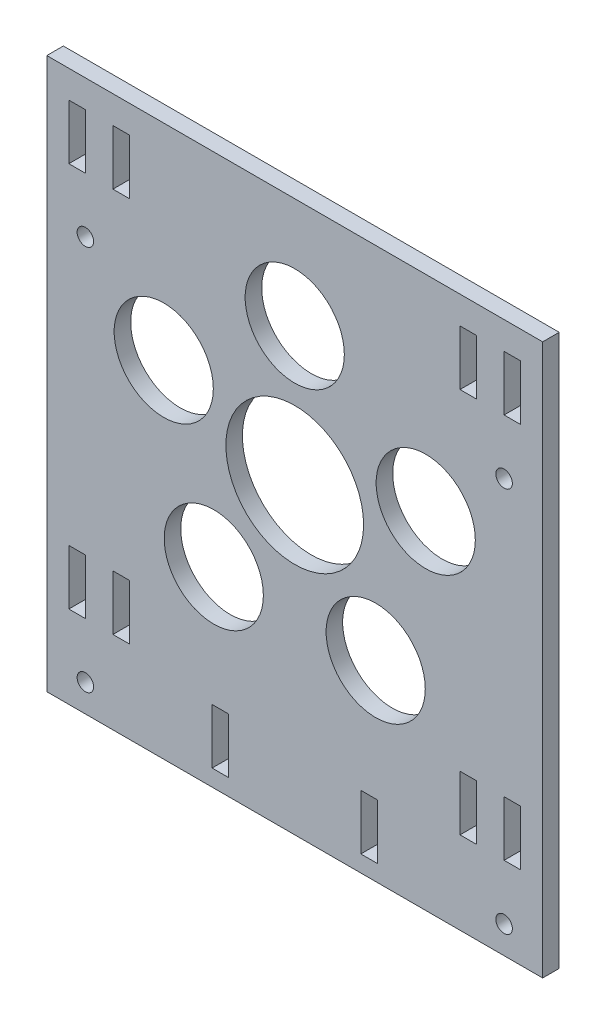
SolidWorks part; units mm, degrees
ref_plane "前视基准面" through (0, 0, 0) normal (0, 0, 1) x (1, 0, 0)
ref_plane "上视基准面" through (0, 0, 0) normal (0, 1, 0) x (1, 0, 0)
ref_plane "右视基准面" through (0, 0, 0) normal (1, 0, 0) x (0, 0, -1)
sketch "草图1" plane through (0, 0, 0) normal (0, 0, 1) x (1, 0, 0)
  line L0 (0, 0) -> (-23.7764, 7.7254) construction
  circle A0 centre (0, 0) radius 12.5
  circle A1 centre (0, 25) radius 12.5
  circle A2 centre (23.7764, 7.7254) radius 12.5
  circle A3 centre (14.6946, -20.2254) radius 12.5
  circle A4 centre (-14.6946, -20.2254) radius 12.5
  circle A5 centre (-23.7764, 7.7254) radius 12.5
  circle A6 centre (-23.7764, 7.7254) radius 10.5
  circle A7 centre (0, 25) radius 10.5
  circle A8 centre (23.7764, 7.7254) radius 10.5
  circle A9 centre (-14.6946, -20.2254) radius 10.5
  circle A10 centre (14.6946, -20.2254) radius 10.5
  circle A11 centre (-23.7764, 7.7254) radius 9
  circle A12 centre (0, 25) radius 9
  circle A13 centre (23.7764, 7.7254) radius 9
  circle A14 centre (14.6946, -20.2254) radius 9
  circle A15 centre (-14.6946, -20.2254) radius 9
  circle A17 centre (0, 0) radius 35.5
  point P16 (0, 0)
  dimension "D1" = 25
  dimension "D2" = 25
  dimension "D4" = 21
  dimension "D5" = 21
  dimension "D6" = 21
  dimension "D7" = 21
  dimension "D8" = 18
  dimension "D11" = 21
  dimension "D3" = 5
  dimension "D10" = 25
  dimension "D9" = 5
sketch "草图2" plane through (0, 0, 0) normal (0, 0, 1) x (1, 0, 0)
  line L0 (-10.5, 25) -> (-10.5, 27.9643)
  line L1 (10.5, 25) -> (10.5, 27.9643)
  line L2 (20.5317, 17.7115) -> (23.3509, 18.6275)
  line L3 (27.0211, -2.2607) -> (29.8403, -1.3447)
  line L4 (23.1893, -14.0537) -> (24.9317, -16.4518)
  line L5 (6.2, -26.3972) -> (7.9423, -28.7953)
  line L6 (-6.2, -26.3972) -> (-7.9423, -28.7953)
  line L7 (-23.1893, -14.0537) -> (-24.9317, -16.4518)
  line L8 (-27.0211, -2.2607) -> (-29.8403, -1.3447)
  line L9 (-20.5317, 17.7115) -> (-23.3509, 18.6275)
  line L11 (0, 0) -> (27.0211, -2.2607) construction
  circle A0 centre (14.6946, -20.2254) radius 10.5 construction
  circle A1 centre (-14.6946, -20.2254) radius 10.5 construction
  circle A2 centre (23.7764, 7.7254) radius 10.5 construction
  circle A3 centre (0, 25) radius 10.5 construction
  circle A4 centre (-23.7764, 7.7254) radius 10.5 construction
  circle A5 centre (0, 0) radius 35.5 construction
  arc A6 (23.1893, -14.0537) -> (6.2, -26.3972) centre (14.6946, -20.2254) ccw
  arc A7 (-6.2, -26.3972) -> (-23.1893, -14.0537) centre (-14.6946, -20.2254) ccw
  arc A8 (20.5317, 17.7115) -> (27.0211, -2.2607) centre (23.7764, 7.7254) ccw
  arc A9 (-10.5, 25) -> (10.5, 25) centre (0, 25) ccw
  arc A10 (-27.0211, -2.2607) -> (-20.5317, 17.7115) centre (-23.7764, 7.7254) ccw
  arc A11 (-16.3413, 31.5153) -> (-24.9231, 25.2802) centre (0, 0) ccw
  arc A12 (-35.0225, -5.8027) -> (-31.7446, -15.8912) centre (0, 0) ccw
  arc A13 (24.9231, 25.2802) -> (16.3413, 31.5153) centre (0, 0) ccw
  arc A14 (31.7446, -15.8912) -> (35.0225, -5.8027) centre (0, 0) ccw
  arc A15 (-5.3039, -35.1016) -> (5.3039, -35.1016) centre (0, 0) ccw
  arc A16 (23.3509, 18.6275) -> (24.9231, 25.2802) centre (22.1148, 22.4318) ccw
  arc A17 (10.5, 27.9643) -> (16.3413, 31.5153) centre (14.5, 27.9643) cw
  arc A18 (-10.5, 27.9643) -> (-16.3413, 31.5153) centre (-14.5, 27.9643) ccw
  arc A19 (-23.3509, 18.6275) -> (-24.9231, 25.2802) centre (-22.1148, 22.4318) cw
  arc A20 (24.9317, -16.4518) -> (31.7446, -15.8912) centre (28.1677, -14.1007) ccw
  arc A21 (7.9423, -28.7953) -> (5.3039, -35.1016) centre (4.7062, -31.1465) cw
  arc A22 (-7.9423, -28.7953) -> (-5.3039, -35.1016) centre (-4.7062, -31.1465) ccw
  arc A23 (-24.9317, -16.4518) -> (-31.7446, -15.8912) centre (-28.1677, -14.1007) cw
  arc A24 (-35.0225, -5.8027) -> (-29.8403, -1.3447) centre (-31.0763, -5.1489) cw
  arc A25 (29.8403, -1.3447) -> (35.0225, -5.8027) centre (31.0763, -5.1489) cw
  dimension "D2" = 4
  dimension "D3" = 4
  dimension "D1" = 5
sketch "草图3" plane through (0, 0, 0) normal (0, 0, 1) x (1, 0, 0)
  line L0 (-45, 45) -> (45, 45)
  line L1 (45, 45) -> (45, -45)
  line L3 (-45, -45) -> (-45, 45)
  line L4 (-45, -45) -> (-45, -55)
  line L7 (-45, -55) -> (45, -55)
  line L8 (45, -45) -> (45, -55)
  dimension "D1" = 90
  dimension "D2" = 90
  dimension "D3" = 10
extrude "凸台-拉伸2" add sketch "草图3" along normal blind 3
sketch "草图4" plane through (0, 0, 3) normal (0, 0, 1) x (1, 0, 0)
  circle A0 centre (0, 0) radius 13.5
sketch "草图5" plane through (0, 0, 3) normal (0, 0, 1) x (1, 0, 0)
  line L0 (-33, 40) -> (-33, 30)
  line L1 (-33, 30) -> (-30, 30)
  line L2 (-30, 30) -> (-30, 40)
  line L3 (-30, 40) -> (-33, 40)
  line L4 (30, 40) -> (30, 30)
  line L5 (30, 30) -> (33, 30)
  line L6 (33, 30) -> (33, 40)
  line L7 (33, 40) -> (30, 40)
  line L8 (-33, -30) -> (-33, -40)
  line L9 (-33, -40) -> (-30, -40)
  line L10 (-30, -40) -> (-30, -30)
  line L11 (-30, -30) -> (-33, -30)
  line L12 (30, -30) -> (30, -40)
  line L13 (30, -40) -> (33, -40)
  line L14 (33, -40) -> (33, -30)
  line L15 (33, -30) -> (30, -30)
  line L16 (0, 45) -> (0, -54.353) construction
  line L17 (-45, 45) -> (45, 45) construction
  line L18 (-45, 0) -> (45, 0) construction
  line L19 (-45, -55) -> (-45, 45) construction
  line L20 (45, -55) -> (45, 45) construction
  dimension "D1" = 3
  dimension "D2" = 10
  dimension "D3" = 10
  dimension "D4" = 3
  dimension "D5" = 10
  dimension "D6" = 3
  dimension "D7" = 3
  dimension "D8" = 10
  dimension "D9" = 30
  dimension "D10" = 30
  dimension "D11" = 30
  dimension "D12" = 30
  dimension "D13" = 30
  dimension "D14" = 30
  dimension "D15" = 30
  dimension "D16" = 30
extrude "切除-拉伸1" cut sketch "草图5" against normal blind 10
sketch "草图6" plane through (0, 0, 3) normal (0, 0, 1) x (1, 0, 0)
  circle A0 centre (23.7764, 7.7254) radius 9 construction
  circle A11 centre (14.6946, -20.2254) radius 9 construction
  circle A12 centre (-14.6946, -20.2254) radius 9 construction
  circle A13 centre (0, 25) radius 9 construction
  circle A14 centre (-23.7764, 7.7254) radius 9 construction
  circle A15 centre (23.7764, 7.7254) radius 9
  circle A16 centre (14.6946, -20.2254) radius 9
  circle A17 centre (-14.6946, -20.2254) radius 9
  circle A18 centre (0, 25) radius 9
  circle A19 centre (-23.7764, 7.7254) radius 9
extrude "切除-拉伸2" cut sketch "草图6" against normal blind 10
sketch "草图7" plane through (0, 0, 3) normal (0, 0, 1) x (1, 0, 0)
  circle A1 centre (0, 0) radius 12.5
  point P11 (0, 0)
extrude "切除-拉伸3" cut sketch "草图7" against normal blind 10
sketch "草图8" plane through (0, 0, 3) normal (0, 0, 1) x (1, 0, 0)
  line L0 (-38, -30) -> (-38, -40)
  line L1 (-38, -40) -> (-41, -40)
  line L2 (-41, -40) -> (-41, -30)
  line L3 (-41, -30) -> (-38, -30)
  line L4 (-38, 30) -> (-38, 40)
  line L5 (-38, 40) -> (-41, 40)
  line L6 (-41, 40) -> (-41, 30)
  line L7 (-41, 30) -> (-38, 30)
  line L8 (-12, -42) -> (-12, -52)
  line L9 (-12, -52) -> (-15, -52)
  line L10 (-15, -52) -> (-15, -42)
  line L11 (-15, -42) -> (-12, -42)
  line L12 (0, 45) -> (0, -54.406) construction
  line L13 (-45, 45) -> (45, 45) construction
  line L14 (-33, 40) -> (-33, 30) construction
  line L15 (-33, 30) -> (-30, 30) construction
  line L16 (15, -42) -> (12, -42)
  line L17 (-30, -30) -> (-33, -30) construction
  line L18 (-45, -55) -> (45, -55) construction
  line L19 (15, -52) -> (15, -42)
  line L20 (12, -52) -> (15, -52)
  line L21 (12, -42) -> (12, -52)
  line L22 (41, 30) -> (38, 30)
  line L23 (41, 40) -> (41, 30)
  line L24 (38, 40) -> (41, 40)
  line L25 (38, 30) -> (38, 40)
  line L26 (41, -30) -> (38, -30)
  line L27 (41, -40) -> (41, -30)
  line L28 (38, -40) -> (41, -40)
  line L29 (38, -30) -> (38, -40)
  circle A0 centre (-38, -50) radius 1.5
  circle A1 centre (-38, 20) radius 1.5
  circle A2 centre (38, 20) radius 1.5
  circle A3 centre (38, -50) radius 1.5
  dimension "D10" = 3
  dimension "D11" = 3
  dimension "D13" = 5
  dimension "D1" = 10
  dimension "D2" = 3
  dimension "D3" = 5
  dimension "D4" = 10
  dimension "D5" = 3
  dimension "D6" = 3
  dimension "D7" = 10
  dimension "D8" = 3
  dimension "D9" = 12
  dimension "D12" = 25
extrude "切除-拉伸4" cut sketch "草图8" against normal blind 10
